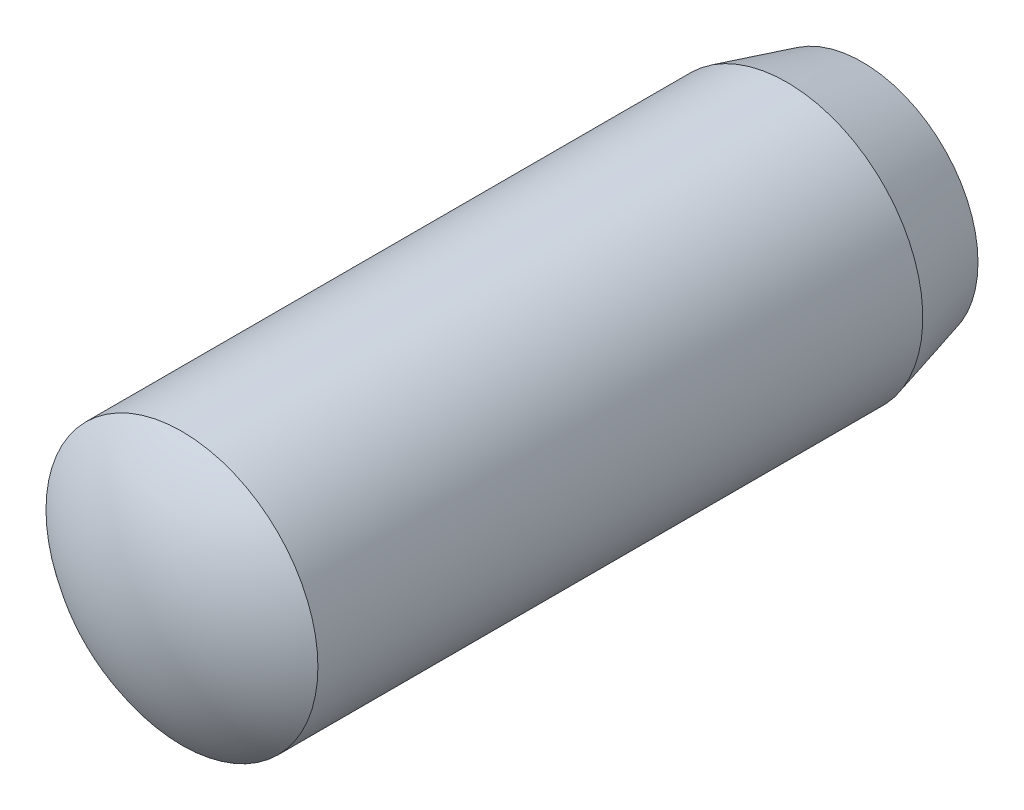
SolidWorks part; units mm, degrees
revolve "Enlever de la matière-Révolution5" cut sketch "Esquisse6"
sketch "Esquisse6"
  line L0 (0, -7) -> (0, 5) construction
  line L1 (-2.5, -7) -> (2.5, -7) construction
  line L3 (-2.5, 5) -> (-2.5, -7) construction
  line L5 (0, -11.8631) -> (0, -1) construction
  line L6 (-2.5, -6.1225) -> (-2.5, -21)
  line L7 (0, -7) -> (0, -21)
  line L8 (0, -21) -> (-2.5, -21)
  arc A0 (-2.5, -6.1225) -> (0, -7) centre (0, -3) ccw
extrude "Base-Extrusion" add sketch "Esquisse2" along normal mid plane 14
sketch "Esquisse2" plane through (0, 0, 0) normal (0, 0, 1) x (1, 0, 0)
  circle A0 centre (0, 0) radius 2.5
  dimension "diamêtre" = 5
revolve "Enlever de la matière-Révolution1" cut sketch "Esquisse3" angle 360 about L2
sketch "Esquisse3" plane through (0, 0, 0) normal (0, 1, 0) x (1, 0, 0)
  line L0 (2.5, 7) -> (-2.5, 7) construction
  line L1 (2.5, 7) -> (1.9641, 7)
  line L2 (0, 11.7994) -> (0, -14.1244) construction
  line L4 (0, -7) -> (0, 7) construction
  line L5 (1.9641, 7) -> (2.5, 5)
  line L6 (2.5, 7) -> (2.5, 5)
  dimension "D1" = 165
  dimension "Haut-ch" = 2
ref_plane "FACE" through (0, 0, 0) normal (0, 0, 1) x (1, 0, 0)
ref_plane "DESSUS" through (0, 0, 0) normal (0, 1, 0) x (1, 0, 0)
ref_plane "DROITE" through (0, 0, 0) normal (1, 0, 0) x (0, 0, -1)
sketch "Esquisse5" plane through (0, 0, 0) normal (0, 1, 0) x (1, 0, 0)
  line L0 (0, -7) -> (0, 5) construction
  line L1 (0, 7) -> (0, 10)
  line L2 (0, 10.5664) -> (0, -3) construction
  line L4 (1.9641, 7) -> (-1.9641, 7) construction
  line L8 (-1.9641, 7) -> (-2.5, 5) construction
  line L9 (-1.1603, 10) -> (0, 10)
  line L10 (-1.1603, 10) -> (-2.1284, 6.3867)
  arc A0 (0, 7) -> (-2.1284, 6.3867) centre (0, 3) ccw
  dimension "D1" = 8
  dimension "D2" = 3
revolve "Enlever de la matière-Révolution4" cut sketch "Esquisse5" angle 360 about L2
other "Bloquer***"
